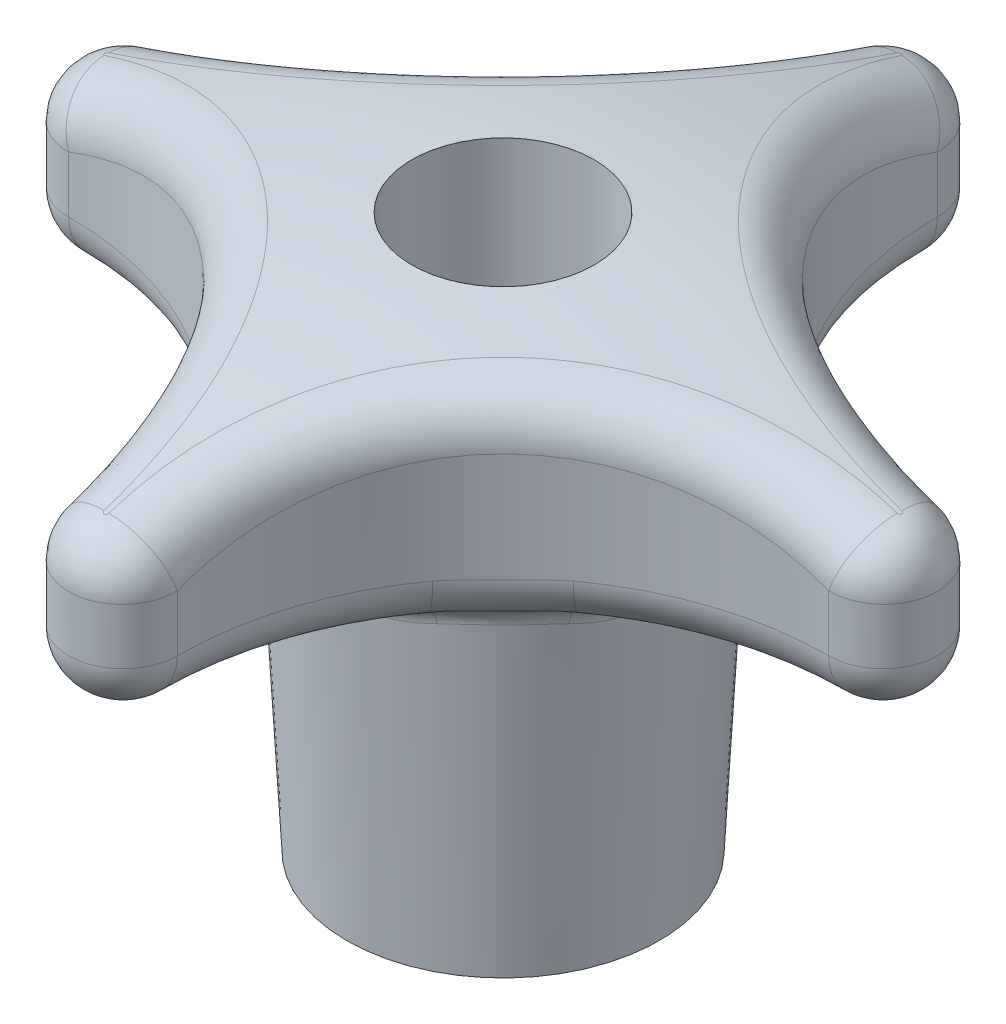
SolidWorks part; units mm, degrees
ref_plane "Front Plane" through (0, 0, 0) normal (0, 0, 1) x (1, 0, 0)
ref_plane "Top Plane" through (0, 0, 0) normal (0, 1, 0) x (1, 0, 0)
ref_plane "Right Plane" through (0, 0, 0) normal (1, 0, 0) x (0, 0, -1)
sketch "Sketch1" plane through (0, 0, 0) normal (0, 1, 0) x (1, 0, 0)
  circle A0 centre (0, 0) radius 9
  dimension "D1" = 18
extrude "Extrude1" add sketch "Sketch1" against normal blind 19.2
draft "Draft1" type of draft neutral plane draft angle 3 faces to draft 1 parameters "D1"=3
sketch "Sketch2" plane through (0, 0, 0) normal (0, 0, 1) x (1, 0, 0)
  line L0 (0, 0) -> (-25, 0)
  line L1 (-25, 0) -> (-25, 8.32)
  line L2 (0, 0) -> (0, 50000) construction
  line L3 (0, 12.8) -> (20.2547, 12.8) construction
  line L4 (0, 0) -> (0, 12.8)
  arc A0 (0, 12.8) -> (-25, 8.32) centre (0, -59.1945) ccw
revolve "Revolve1" add sketch "Sketch2" angle 360 about L2
sketch "Sketch4" plane through (0, 0, 0) normal (0, 1, 0) x (1, 0, 0)
  line L0 (0, 0) -> (-50000, 0) construction
  line L1 (0, 0) -> (0, 50000) construction
  line L2 (-21.875, 3.125) -> (-45.9117, 3.125) construction
  line L3 (-3.125, 21.875) -> (-3.125, 40.3224) construction
  arc A0 (0, 25) -> (-3.125, 21.875) centre (0, 21.875) ccw
  arc A1 (-21.875, 3.125) -> (-25, 0) centre (-21.875, 0) ccw
  circle A2 centre (0, 0) radius 25 construction
  arc A3 (-21.875, 3.125) -> (-3.125, 21.875) centre (-21.875, 21.875) ccw
  arc A4 (0, 25) -> (-25, 0) centre (-25, 25) ccw
  point P9 (0, 25)
  point P10 (-25, 0)
  point P13 (-3.125, 21.875)
  point P14 (-21.875, 3.125)
extrude "Extrude3" cut sketch "Sketch4" along normal through all
pattern_circular "CirPattern1" count 4 over 360 about axis through (0, 0, 0) along (0, 1, 0) of "Extrude3"
fillet "Fillet2" radius 3 16 edges at (0, 0, 25) (8.6167, 0, 8.6167) (25, 0, 0) (8.6167, 0, -8.6167) (0, 0, -25) (-8.6167, 0, -8.6167) (-25, 0, 0) (-0.0002, 8.32, 25) (10.5247, 11.6866, 6.9508) (25, 8.32, 0.0002) (6.9508, 11.6866, -10.5247) (0.0002, 8.32, -25) (-10.5247, 11.6866, -6.9508) (-25, 8.32, 0.0002) (-8.6167, 0, 8.6167) (-6.9508, 11.6866, 10.5247)
fillet "Fillet3" radius 1.5 8 edges at (-7.0755, 0, -7.0755) (0, 0, -10.0062) (7.0755, 0, -7.0755) (10.0062, 0, 0) (7.0755, 0, 7.0755) (0, 0, 10.0062) (-7.0755, 0, 7.0755) (-10.0062, 0, 0)
sketch "Sketch6" [suppressed] plane through (0, -30, 0) normal (0, -1, 0) x (1, 0, 0)
  circle A0 centre (0, 0) radius 8
  dimension "D1" = 8
extrude "Extrude5" [suppressed] cut sketch "Sketch6" against normal blind 18
sketch "Sketch7" [suppressed] plane through (0, 0, 0) normal (0, 0, 1) x (1, 0, 0)
  line L0 (0, 2) -> (8, 2)
  line L1 (8, -30) -> (8, 2) construction
  line L2 (8, 2) -> (0, 6.6188)
  line L3 (0, 6.6188) -> (0, 2)
  line L4 (-8, -30) -> (8, -30) construction
revolve "Cut-Revolve1" [suppressed] cut sketch "Sketch7" angle 360 about L3
sketch "Sketch8" plane through (0, -19.2, 0) normal (0, -1, 0) x (1, 0, 0)
  circle A0 centre (0, 0) radius 5
  dimension "D1" = 10
extrude "Extrude6" cut sketch "Sketch8" against normal blind 16
sketch "Sketch9" plane through (0, -3.2, 0) normal (0, -1, 0) x (1, 0, 0)
  circle A0 centre (0, 0) radius 5.25
  dimension "D1" = 10.5
extrude "Extrude7" cut sketch "Sketch9" against normal through all
sketch "Sketch10" [suppressed] plane through (0, -24, 0) normal (0, -1, 0) x (1, 0, 0)
  circle A0 centre (0, 0) radius 6
extrude "Extrude8" [suppressed] cut sketch "Sketch10" against normal blind 15
sketch "Sketch11" [suppressed] plane through (0, 0, 0) normal (0, 0, 1) x (1, 0, 0)
  line L0 (5.1, 7.0555) -> (5.1, -2)
  line L1 (0, 0) -> (0, -5.4531) construction
  line L2 (5.1, 7.0555) -> (0, 10)
  line L3 (0, 10) -> (0, -2)
  line L4 (-6, -2) -> (6, -2) construction
  line L5 (5.1, -2) -> (0, -2)
revolve "Cut-Revolve2" [suppressed] cut sketch "Sketch11" angle 360 about L3
equation "\"D2@Sketch2\" = \"D1@Sketch2\"*.65"
equation "\"D1@Sketch4\" = (\"D3@Sketch2\"*2)/8"
equation "\"D2@Sketch4\" =( \"D3@Sketch2\"*2)/8"
equation "\"D1@Sketch7\" = \"D1@Extrude5\""
equation "\"D1@Fillet3\" = \"D1@Fillet2\"/2"
equation "\"D2@Sketch11\" = \"D1@Sketch10\""
